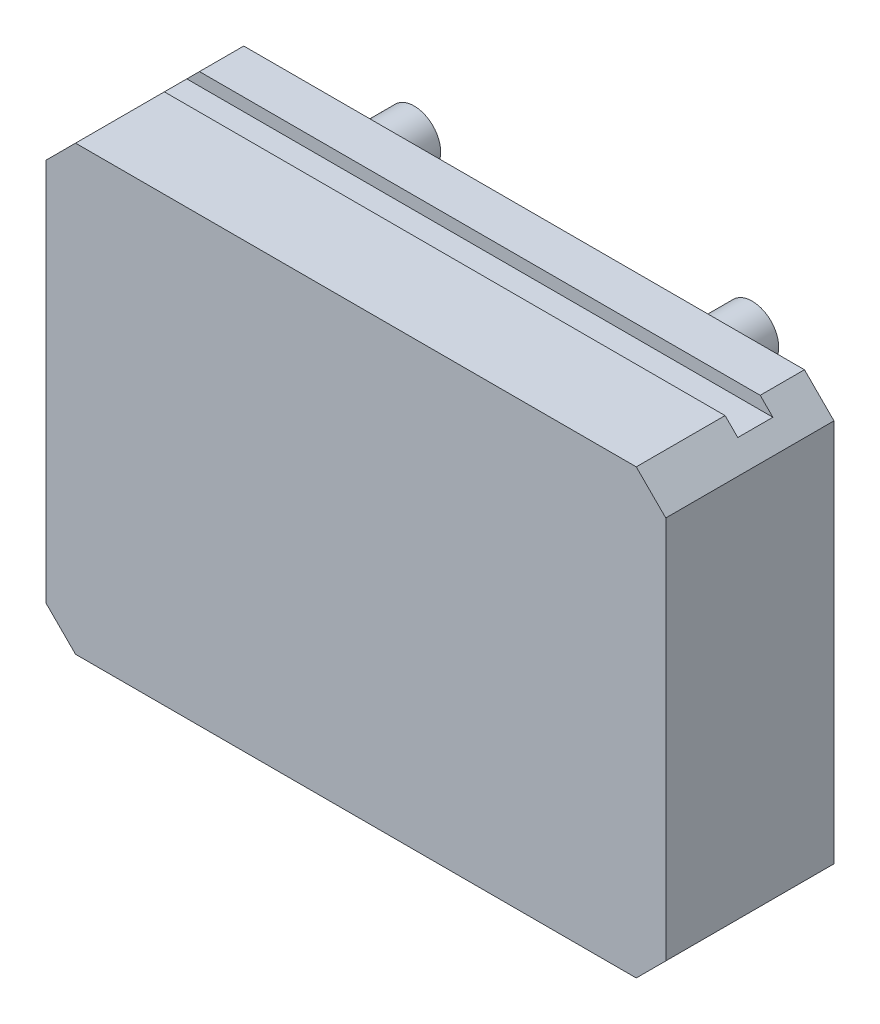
SolidWorks part; units mm, degrees
ref_plane "Přední rovina" through (0, 0, 0) normal (0, 0, 1) x (1, 0, 0)
ref_plane "Horní rovina" through (0, 0, 0) normal (0, 1, 0) x (1, 0, 0)
ref_plane "Pravá rovina" through (0, 0, 0) normal (1, 0, 0) x (0, 0, -1)
sketch "Skica1" plane through (0, 0, 0) normal (0, 0, 1) x (1, 0, 0)
  line L0 (-105, 75) -> (105, -75) construction
  line L1 (-105, -75) -> (105, -75)
  line L2 (-105, -75) -> (-105, 75)
  line L3 (-105, 75) -> (105, 75)
  line L4 (105, -75) -> (105, 75)
  dimension "D1" = 150
  dimension "D2" = 210
extrude "Vysunout1" add sketch "Skica1" along normal blind 57
chamfer "Zkosit1" distance 10 angle 45 4 edges at (105, 75, 28.5) (-105, 75, 28.5) (105, -75, 28.5) (-105, -75, 28.5)
sketch "Skica2" plane through (0, -75, 0) normal (0, -1, 0) x (1, 0, 0)
  line L0 (-105, 0) -> (-105, 57) construction
  line L1 (-105, 15) -> (105, 15)
  line L2 (-105, 15) -> (-105, 26.9)
  line L3 (-105, 26.9) -> (105, 26.9)
  line L4 (105, 15) -> (105, 26.9)
  line L5 (105, 57) -> (105, 0) construction
  line L6 (-95, 0) -> (95, 0) construction
  dimension "D1" = 11.9
  dimension "D2" = 15
extrude "Odebrat vysunutím1" cut sketch "Skica2" against normal blind 4.3
mirror "Zrcadlit1" about plane through (0, 0, 0) normal (0, 1, 0) of "Odebrat vysunutím1"
sketch "Skica3" plane through (0, 0, 0) normal (0, 0, -1) x (-1, 0, 0)
  line L0 (-57.2756, -57.2756) -> (0, -57.2756) construction
  line L1 (0, -57.2756) -> (0, 0) construction
  circle A0 centre (-57.2756, -57.2756) radius 8 construction
  circle A1 centre (0, 0) radius 81 construction
  dimension "D1" = 16
  dimension "D4" = 162
ref_plane "Rovina1" through (57.2756, 0, 0) normal (1, 0, 0) x (0, 0, -1)
sketch "Skica7" plane through (57.2756, 0, 0) normal (1, 0, 0) x (0, 0, -1)
  line L0 (0, -57.2756) -> (22.6562, -57.2756) construction
  line L1 (0, -57.2756) -> (0, -67.2756)
  line L2 (0, -65.2756) -> (0, -49.2756) construction
  line L3 (0, -67.2756) -> (3, -67.2756)
  line L4 (3, -67.2756) -> (4, -66.2756)
  line L5 (4, -66.2756) -> (20, -66.2756)
  line L6 (20, -66.2756) -> (20, -57.2756)
  line L7 (20, -57.2756) -> (0, -57.2756)
  dimension "D1" = 20
  dimension "D2" = 1
  dimension "D3" = 45
  dimension "D4" = 18
  dimension "D5" = 4
revolve "Rotovat1" add sketch "Skica7" angle 360 about L0
mirror "Zrcadlit2" about plane through (0, 0, 0) normal (1, 0, 0) of "Rotovat1"
mirror "Zrcadlit3" about plane through (0, 0, 0) normal (0, 1, 0) of "Zrcadlit2", "Rotovat1"
sketch "Skica6" plane through (-105, 0, 0) normal (-1, 0, 0) x (0, 0, 1)
  line L1 (0, 0) -> (57, 0) construction
  line L2 (0, 65) -> (0, -65) construction
  line L3 (57, 65) -> (57, -65) construction
  circle A0 centre (38.2, 0) radius 7.5
  dimension "D1" = 15
  dimension "D2" = 38.2
extrude "Vysunout4" add sketch "Skica6" along normal blind 10
